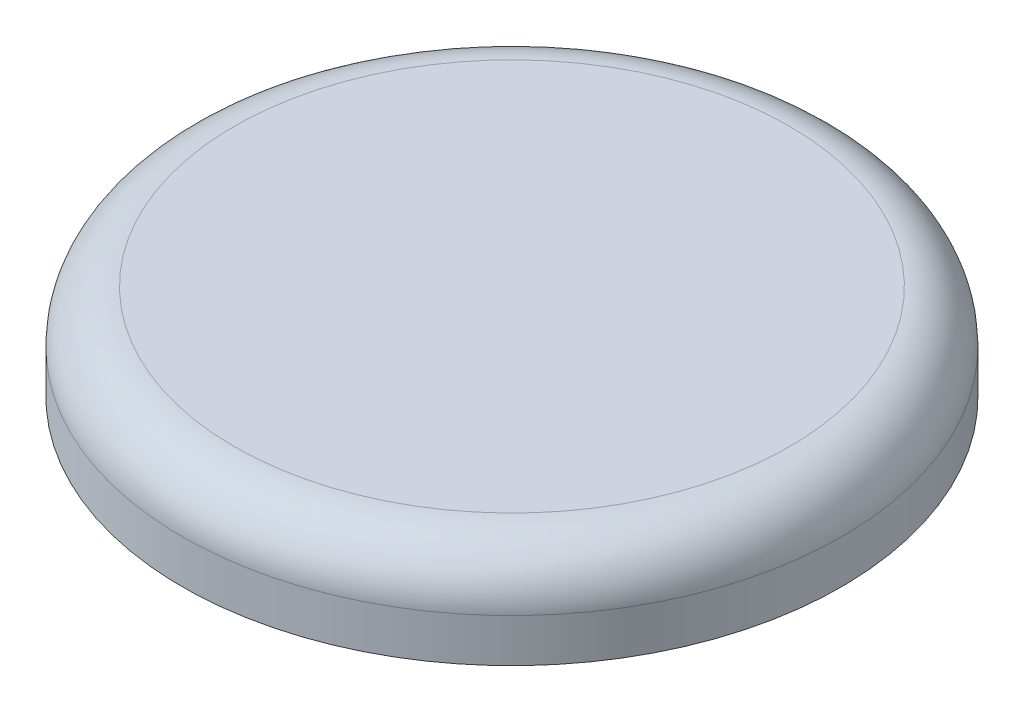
SolidWorks part; units mm, degrees
ref_plane "Plan de face" through (0, 0, 0) normal (0, 0, 1) x (1, 0, 0)
ref_plane "Plan de dessus" through (0, 0, 0) normal (0, 1, 0) x (1, 0, 0)
ref_plane "Plan de droite" through (0, 0, 0) normal (1, 0, 0) x (0, 0, -1)
sketch "Esquisse1" plane through (0, 0, 0) normal (0, 0, 1) x (1, 0, 0)
  line L0 (0, 0) -> (0, 59.9602) construction
  line L1 (0, -55) -> (0, 55) construction
  line L2 (0, 0) -> (-19, 0)
  line L3 (-19, 0) -> (-19, -5.5)
  line L4 (-19, -5.5) -> (-16.5, -5.5)
  line L5 (-16.5, -5.5) -> (-16.1938, -2)
  line L6 (-16.1938, -2) -> (-9.5, -2)
  line L7 (-9.5, -2) -> (-9.5, -12)
  line L8 (-9.5, -12) -> (-7.625, -12)
  line L9 (-7.625, -12) -> (-7.1884, -2)
  line L10 (-7.1884, -2) -> (0, -2)
  line L11 (0, -2) -> (0, 0)
  dimension "D1" = 38
  dimension "D2" = 19
  dimension "D3" = 2.5
  dimension "D4" = 2
  dimension "D5" = 2.5
  dimension "D6" = 5.5
  dimension "D7" = 10
  dimension "D8" = 15.25
  dimension "D9" = 5
revolve "Révolution1" add sketch "Esquisse1" angle 360 about L0
fillet "Congé1" radius 3 1 edges at (0, 0, -19)
fillet "Congé2" radius 1 2 edges at (0, -2, -9.5) (0, -2, -16.1938)
sketch "Esquisse2" plane through (0, 0, 0) normal (0, 0, 1) x (1, 0, 0)
  line L0 (0, 0) -> (0, -22.9633) construction
  line L1 (0, -6.7188) -> (0, 6.7188) construction
  line L2 (-7.1884, -2) -> (-7.625, -12) construction
  line L3 (-7.3835, -6.4695) -> (-7.4265, -7.4546)
  line L5 (-15.2775, -2) -> (15.2775, -2) construction
  arc A0 (-7.3835, -6.4695) -> (-7.4265, -7.4546) centre (-6.5359, -7) ccw
  dimension "D2" = 1
  dimension "D3" = 0.13
  dimension "D1" = 5
revolve "Enlèvement de matière-Révolution1" cut sketch "Esquisse2" angle 360 about L0
scale "Echelle1" scale about origin uniform scaling yes scale factor 1.018
